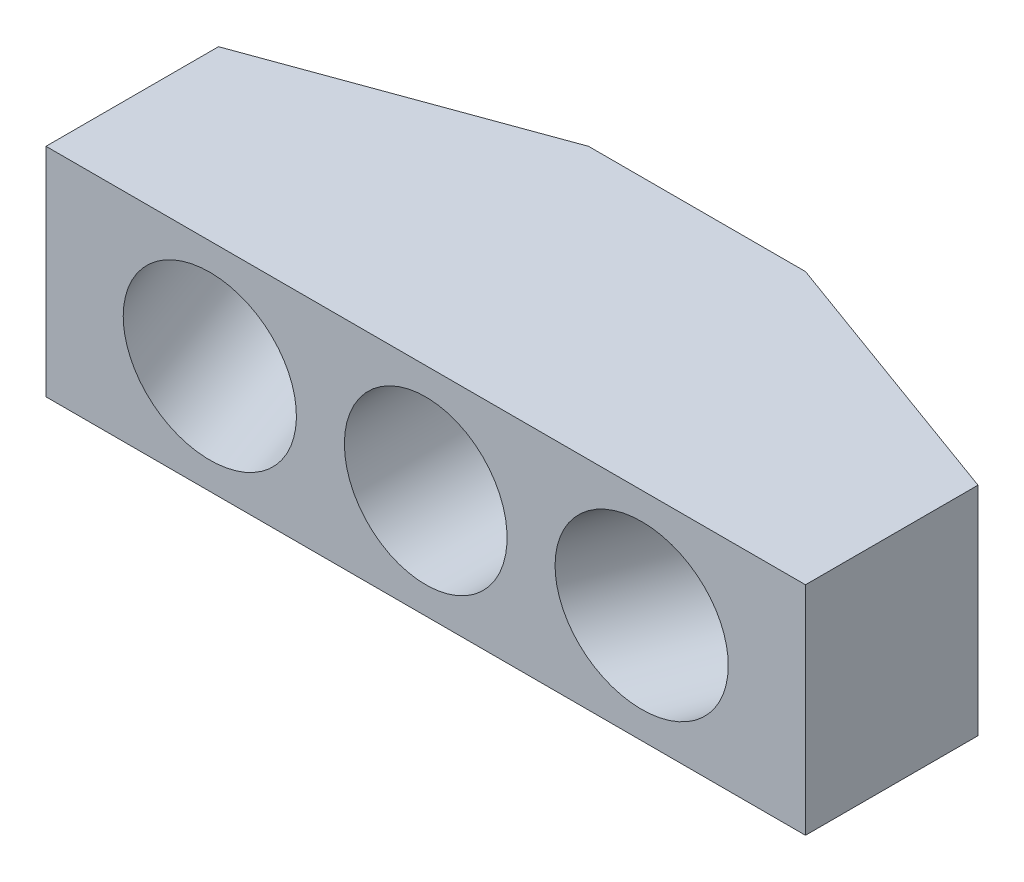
SolidWorks part; units mm, degrees
ref_plane "前视基准面" through (0, 0, 0) normal (0, 0, 1) x (1, 0, 0)
ref_plane "上视基准面" through (0, 0, 0) normal (0, 1, 0) x (1, 0, 0)
ref_plane "右视基准面" through (0, 0, 0) normal (1, 0, 0) x (0, 0, -1)
other "Configuration Table"
sketch "草图1" plane through (0, 0, 0) normal (0, 1, 0) x (1, 0, 0)
  line L1 (-14, 0) -> (14, 0)
  line L2 (0, 0) -> (0, 10) construction
  line L4 (14, 0) -> (14, 6.3603)
  line L5 (-4, 10) -> (4, 10)
  line L7 (4, 10) -> (9.4159, 8.0288)
  line L8 (9.4159, 8.0288) -> (14, 6.3603)
  line L9 (-9.4159, 8.0288) -> (-14, 6.3603)
  line L10 (-4, 10) -> (-9.4159, 8.0288)
  line L11 (-14, 0) -> (-14, 6.3603)
  dimension "D1" = 10
  dimension "D2" = 14
  dimension "D3" = 70
  dimension "D4" = 4
  dimension "D5" = 180
extrude "凸台-拉伸1" add sketch "草图1" along normal mid plane 8
sketch "草图4" plane through (0, 0, -10) normal (0, 0, -1) x (-1, 0, 0)
  point P0 (0, 0)
hole_wizard "M6 螺纹孔1" positions "草图4" profile "草图3" tap size "M6" standard "GB"
sketch "草图3" plane through (0, 0, -10) normal (1, 0, 0) x (0, 1, 0)
  line L0 (0, 0) -> (0, 10)
  line L1 (0, 10) -> (3, 10)
  line L2 (3, 10) -> (3, 0.025)
  line L3 (3, 0.025) -> (3.025, 0)
  line L5 (3.025, 0) -> (0, 0)
  line L6 (-3, 0.025) -> (-3.025, 0) construction
  line L11 (0, -6.35) -> (0, 107.95) construction
  dimension "通孔螺纹孔钻头直径" = 6
  dimension "通孔螺纹孔钻头深度" = 10
  dimension "近端锥形沉头孔直径" = 6.05
  dimension "近端锥形沉头孔角度" = 90
sketch "草图7" plane through (3.6818, 0, -10.1158) normal (0.342, 0, -0.9397) x (-0.9397, 0, -0.342)
  line L3 (-10.9803, -4) -> (-0.3386, -4) construction
  line L4 (-10.9803, 4) -> (-10.9803, -4) construction
  point P0 (-7.4803, 0)
  point P9 (-15.751, -2.0326)
  dimension "D1" = 4
  dimension "D2" = 3.5
hole_wizard "M6 螺纹孔2" positions "草图7" profile "草图6" tap size "M6" standard "GB"
sketch "草图6" plane through (10.7111, 0, -7.5574) normal (0, 1, 0) x (-0.9397, 0, -0.342)
  line L0 (0, 0) -> (0, 15.5533)
  line L1 (0, 15.5533) -> (3, 15.5533)
  line L2 (3, 15.5533) -> (3, 0.025)
  line L3 (3, 0.025) -> (3.025, 0)
  line L5 (3.025, 0) -> (0, 0)
  line L6 (-3, 0.025) -> (-3.025, 0) construction
  line L11 (0, -6.35) -> (0, 107.95) construction
  dimension "通孔螺纹孔钻头直径" = 6
  dimension "通孔螺纹孔钻头深度" = 15.5533
  dimension "近端锥形沉头孔直径" = 6.05
  dimension "近端锥形沉头孔角度" = 90
mirror "镜向1" about plane through (0, 0, 0) normal (1, 0, 0) of "M6 螺纹孔2"
chamfer "倒角2" distance 0.2 3 edges at (-13.5216, 0, -6.5078) (-3.025, 0, -10) (7.8685, 0, -8.592)
